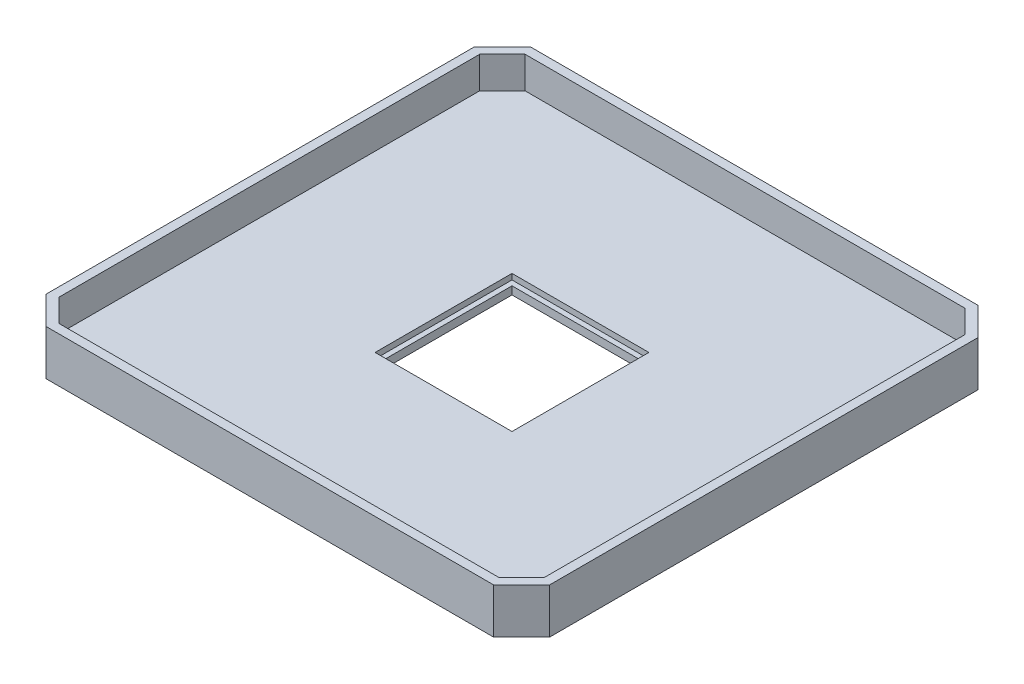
SolidWorks part; units mm, degrees
ref_plane "Front Plane" through (0, 0, 0) normal (0, 0, 1) x (1, 0, 0)
ref_plane "Top Plane" through (0, 0, 0) normal (0, 1, 0) x (1, 0, 0)
ref_plane "Right Plane" through (0, 0, 0) normal (1, 0, 0) x (0, 0, -1)
sketch "Sketch1" plane through (0, 0, 0) normal (0, 1, 0) x (1, 0, 0)
  line L0 (48.625, 51.5) -> (53.625, 46.5)
  line L1 (-48.625, -51.5) -> (48.625, -51.5)
  line L2 (-53.625, -46.5) -> (-53.625, 46.5)
  line L3 (-48.625, 51.5) -> (48.625, 51.5)
  line L4 (53.625, -46.5) -> (53.625, 46.5)
  line L5 (-53.625, -51.5) -> (53.625, 51.5) construction
  line L6 (-53.625, 51.5) -> (53.625, -51.5) construction
  line L7 (-53.625, 46.5) -> (-48.625, 51.5)
  line L8 (-53.625, -46.5) -> (-48.625, -51.5)
  line L9 (48.625, -51.5) -> (53.625, -46.5)
  line L10 (-55.625, -47.3284) -> (-55.625, 47.3284)
  line L11 (-55.625, 47.3284) -> (-49.4534, 53.5)
  line L12 (-49.4534, 53.5) -> (49.4534, 53.5)
  line L13 (49.4534, 53.5) -> (55.625, 47.3284)
  line L14 (55.625, -47.3284) -> (55.625, 47.3284)
  line L15 (49.4534, -53.5) -> (55.625, -47.3284)
  line L16 (-49.4534, -53.5) -> (49.4534, -53.5)
  line L17 (-55.625, -47.3284) -> (-49.4534, -53.5)
  point P0 (0, 0)
  dimension "D1" = 107.25
  dimension "D2" = 103
  dimension "D3" = 2
extrude "Extruded Walls" add sketch "Sketch1" along normal blind 10
sketch "Sketch2" plane through (0, 0, 0) normal (0, -1, 0) x (1, 0, 0)
  line L0 (48.625, 51.5) -> (53.625, 46.5) construction
  line L1 (53.625, -46.5) -> (48.625, -51.5) construction
  line L2 (53.625, 46.5) -> (53.625, -46.5) construction
  line L3 (48.625, -51.5) -> (-48.625, -51.5) construction
  line L4 (-48.625, -51.5) -> (-53.625, -46.5) construction
  line L5 (-48.625, 51.5) -> (48.625, 51.5) construction
  line L6 (-53.625, 46.5) -> (-48.625, 51.5) construction
  line L7 (-53.625, -46.5) -> (-53.625, 46.5) construction
  line L8 (48.625, 51.5) -> (53.625, 46.5)
  line L9 (53.625, -46.5) -> (48.625, -51.5)
  line L10 (53.625, 46.5) -> (53.625, -46.5)
  line L11 (48.625, -51.5) -> (-48.625, -51.5)
  line L12 (-48.625, -51.5) -> (-53.625, -46.5)
  line L13 (-48.625, 51.5) -> (48.625, 51.5)
  line L14 (-53.625, 46.5) -> (-48.625, 51.5)
  line L15 (-53.625, -46.5) -> (-53.625, 46.5)
  line L24 (-14, -14) -> (14, -14)
  line L28 (-14, -14) -> (-14, 14)
  line L32 (-14, 14) -> (14, 14)
  line L33 (14, -14) -> (14, 14)
  line L34 (-14, -14) -> (14, 14) construction
  line L35 (-14, 14) -> (14, -14) construction
  point P5 (0, 0)
  point P44 (0, 0)
  dimension "D1" = 14
extrude "Extruded Bottom" add sketch "Sketch2" against normal blind 3
sketch "Sketch5" plane through (0, 3, 0) normal (0, 1, 0) x (1, 0, 0)
  line L1 (-15.125, -15.125) -> (15.125, -15.125)
  line L2 (-15.125, -15.125) -> (-15.125, 15.125)
  line L3 (-15.125, 15.125) -> (15.125, 15.125)
  line L4 (15.125, -15.125) -> (15.125, 15.125)
  line L5 (-15.125, -15.125) -> (15.125, 15.125) construction
  line L6 (-15.125, 15.125) -> (15.125, -15.125) construction
  point P1 (0, 0)
  dimension "D1" = 15.125
extrude "Sensor Glass Hole" cut sketch "Sketch5" against normal blind 1.25
